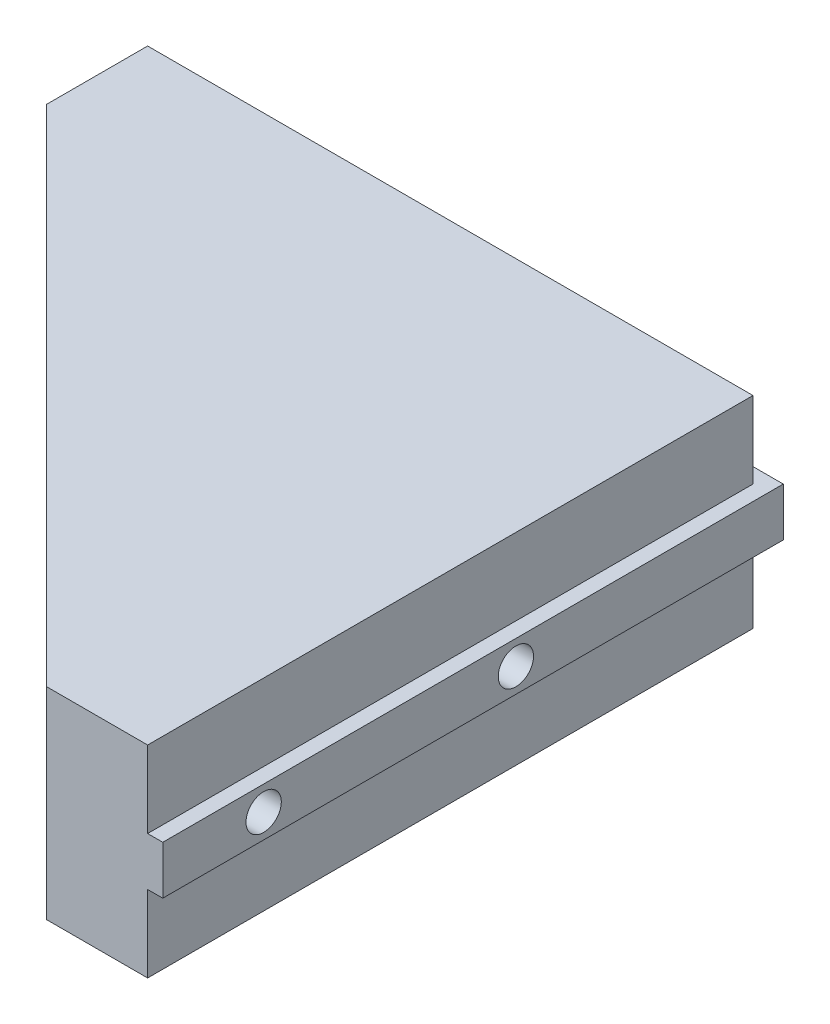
SolidWorks part; units mm, degrees
ref_plane "Ebene vorne" through (0, 0, 0) normal (0, 0, 1) x (1, 0, 0)
ref_plane "Ebene oben" through (0, 0, 0) normal (0, 1, 0) x (1, 0, 0)
ref_plane "Ebene rechts" through (0, 0, 0) normal (1, 0, 0) x (0, 0, -1)
sketch "Skizze1" plane through (0, 0, 0) normal (0, 1, 0) x (1, 0, 0)
  line L0 (-60, 0) -> (0, 0)
  line L1 (0, 0) -> (0, -60)
  line L2 (0, -60) -> (-10, -60)
  line L4 (-60, -10) -> (-60, 0)
  line L5 (-60, -10) -> (-20, -10)
  line L6 (-20, -10) -> (-10, -20)
  line L7 (-10, -20) -> (-10, -60)
  dimension "D1" = 60
  dimension "D2" = 10
  dimension "D3" = 10
extrude "Aufsatz-Linear austragen1" add sketch "Skizze1" along normal mid plane 20
sketch "Skizze2" plane through (0, 0, 0) normal (0, 1, 0) x (1, 0, 0)
  line L0 (0, 0) -> (-60, 0)
  line L1 (-60, 0) -> (-60, 1.5)
  line L2 (-60, 1.5) -> (1.5, 1.5)
  line L3 (1.5, 1.5) -> (1.5, -60)
  line L4 (1.5, -60) -> (0, -60)
  line L5 (0, -60) -> (0, 0)
  dimension "D1" = 1.5
extrude "Aufsatz-Linear austragen2" add sketch "Skizze2" along normal mid plane 4.8
hole_wizard "Ø3.5 (3.5) Durchmesser Bohrung1" positions "Skizze3" profile "Skizze4" hole size "Ø3.5" standard "DIN"
sketch "Skizze3" plane through (1.5, 0, 0) normal (1, 0, 0) x (0, 0, -1)
  line L0 (-60, 2.4) -> (-60, -2.4) construction
  point P0 (-50, 0)
  point P5 (-25, 0)
  dimension "D1" = 10
  dimension "D2" = 25
sketch "Skizze4" plane through (1.5, 0, 50) normal (0, 1, 0) x (0, 0, -1)
  line L0 (0, 0) -> (0, 61.5)
  line L1 (0, 61.5) -> (1.75, 61.5)
  line L2 (1.75, 61.5) -> (1.75, 0)
  line L5 (1.75, 0) -> (0, 0)
  line L11 (0, -6.35) -> (0, 107.95) construction
  dimension "Bohrerdurchmesser" = 3.5
  dimension "Bohrungstiefe" = 61.5
hole_wizard "Ø3.5 (3.5) Durchmesser Bohrung2" positions "Skizze5" profile "Skizze6" hole size "Ø3.5" standard "DIN"
sketch "Skizze5" plane through (0, 0, -1.5) normal (0, 0, -1) x (-1, 0, 0)
  line L0 (60, 2.4) -> (60, -2.4) construction
  point P0 (50, 0)
  point P2 (25, 0)
  dimension "D1" = 10
  dimension "D2" = 25
sketch "Skizze6" plane through (-50, 0, -1.5) normal (1, 0, 0) x (0, 1, 0)
  line L0 (0, 0) -> (0, 61.5)
  line L1 (0, 61.5) -> (1.75, 61.5)
  line L2 (1.75, 61.5) -> (1.75, 0)
  line L5 (1.75, 0) -> (0, 0)
  line L11 (0, -6.35) -> (0, 107.95) construction
  dimension "Bohrerdurchmesser" = 3.5
  dimension "Bohrungstiefe" = 61.5
ref_plane "Ebene1" through (-6.5, 0, 0) normal (1, 0, 0) x (0, 0, -1)
ref_plane "Ebene2" through (0, 0, 6.5) normal (0, 0, -1) x (-1, 0, 0)
sketch "Skizze7" plane through (-6.5, 0, 0) normal (1, 0, 0) x (0, 0, -1)
  circle A0 centre (-50, 0) radius 3.5
  circle A1 centre (-25, 0) radius 3.5
  dimension "D1" = 7
extrude "Schnitt-Linear austragen1" cut sketch "Skizze7" against normal through all
sketch "Skizze8" plane through (0, 0, 6.5) normal (0, 0, -1) x (-1, 0, 0)
  circle A0 centre (25, 0) radius 3.5
  circle A1 centre (50, 0) radius 3.5
  dimension "D1" = 7
extrude "Schnitt-Linear austragen2" cut sketch "Skizze8" against normal through all
sketch "Skizze9" plane through (0, 10, 0) normal (0, 1, 0) x (1, 0, 0)
  line L0 (-60, -10) -> (-10, -60)
  line L1 (-10, -60) -> (-10, -20)
  line L2 (-10, -20) -> (-20, -10)
  line L3 (-20, -10) -> (-60, -10)
extrude "Aufsatz-Linear austragen3" add sketch "Skizze9" against normal blind 6
